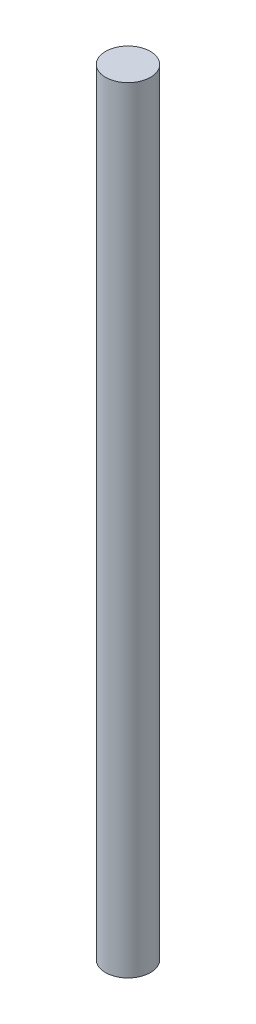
SolidWorks part; units mm, degrees
ref_plane "Plane1" through (0, 0, 0) normal (0, 0, 1) x (1, 0, 0)
ref_plane "Plane2" through (0, 0, 0) normal (0, 1, 0) x (1, 0, 0)
ref_plane "Plane3" through (0, 0, 0) normal (1, 0, 0) x (0, 0, -1)
sketch "Sketch1" plane through (0, -109.5442, 0) normal (0, 1, 0) x (-1, 0, 0)
  circle A0 centre (0, 0) radius 6.35 construction
  circle A1 centre (0, 0) radius 6.35
extrude "Extrude1" add sketch "Sketch1" along normal blind 219.202
